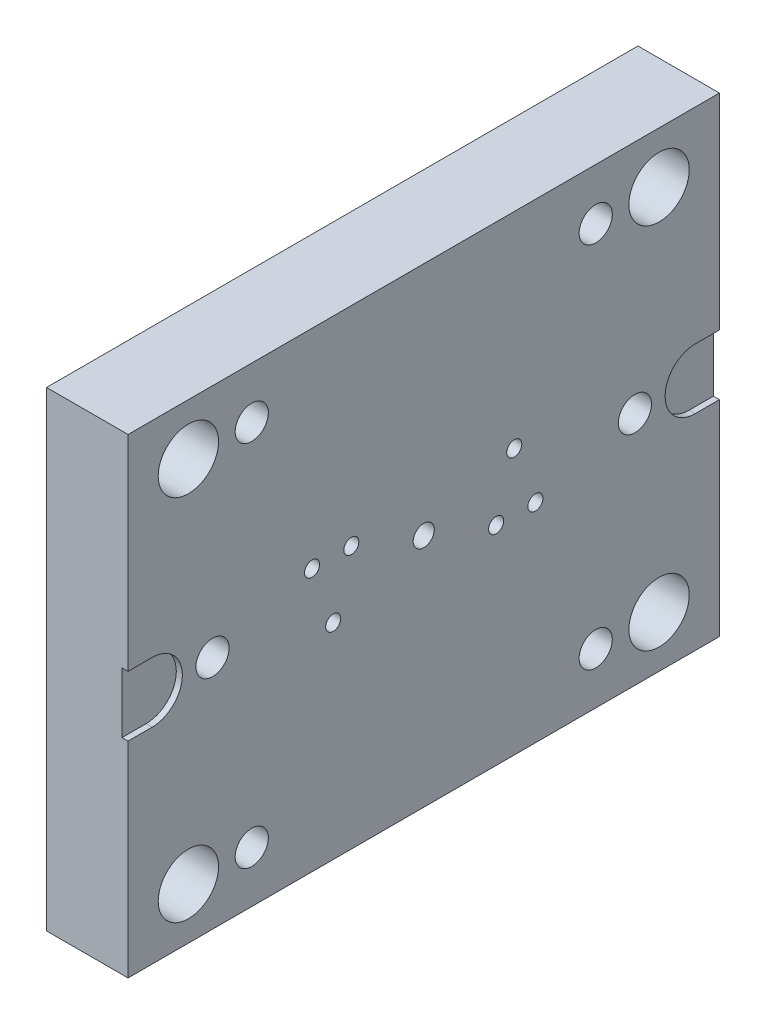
SolidWorks part; units mm, degrees
ref_plane "Face" through (0, 0, 0) normal (0, 0, 1) x (1, 0, 0)
ref_plane "Dessus" through (0, 0, 0) normal (0, 1, 0) x (1, 0, 0)
ref_plane "Droite" through (0, 0, 0) normal (1, 0, 0) x (0, 0, -1)
imported_body "Importée1"
sketch "Esquisse1" plane through (-75, 0, 0) normal (1, 0, 0) x (0, 0, -1)
  line L0 (-98, 156) -> (-98, 0) construction
  line L1 (-196, 156) -> (0, 156) construction
  line L2 (0, 0) -> (-196, 0) construction
  line L3 (-196, 78) -> (0, 78) construction
  line L4 (-196, 0) -> (-196, 156) construction
  line L5 (0, 156) -> (0, 0) construction
  circle A0 centre (-135, 87) radius 2.5
  circle A1 centre (-122, 87) radius 2.5
  circle A2 centre (-128, 68) radius 2.5
  circle A3 centre (-68, 88) radius 2.5
  circle A4 centre (-74, 69) radius 2.5
  circle A5 centre (-61, 69) radius 2.5
  circle A6 centre (-98, 78) radius 3.5
  dimension "D1" = 5
  dimension "D14" = 7
  dimension "D2" = 10
  dimension "D3" = 10
  dimension "D4" = 9
  dimension "D5" = 9
  dimension "D6" = 9
  dimension "D7" = 9
  dimension "D8" = 24
  dimension "D9" = 30
  dimension "D10" = 37
  dimension "D11" = 24
  dimension "D12" = 30
  dimension "D13" = 37
extrude "Enlèv. mat.-Extru.1" cut sketch "Esquisse1" against normal through all
sketch "Esquisse2" plane through (-75, 0, 0) normal (1, 0, 0) x (0, 0, -1)
  circle A0 centre (-28, 78) radius 5.5
  circle A1 centre (-168, 78) radius 5.5
  dimension "D1" = 11
  dimension "D2" = 70
  dimension "D3" = 70
extrude "Enlèv. mat.-Extru.2" cut sketch "Esquisse2" against normal through all
sketch "Esquisse3" plane through (-75, 0, 0) normal (1, 0, 0) x (0, 0, -1)
  line L0 (-8, 88) -> (0, 88)
  line L1 (0, 156) -> (0, 0) construction
  line L2 (0, 88) -> (0, 68)
  line L3 (0, 68) -> (-8, 68)
  line L4 (-188, 88) -> (-196, 88)
  line L5 (-196, 0) -> (-196, 156) construction
  line L6 (-196, 88) -> (-196, 68)
  line L7 (-196, 68) -> (-188, 68)
  arc A0 (-8, 88) -> (-8, 68) centre (-8, 78) ccw
  arc A1 (-188, 88) -> (-188, 68) centre (-188, 78) cw
  dimension "D3" = 10
  dimension "D4" = 10
  dimension "D1" = 8
  dimension "D2" = 8
extrude "Enlèv. mat.-Extru.3" cut sketch "Esquisse3" against normal blind 2
